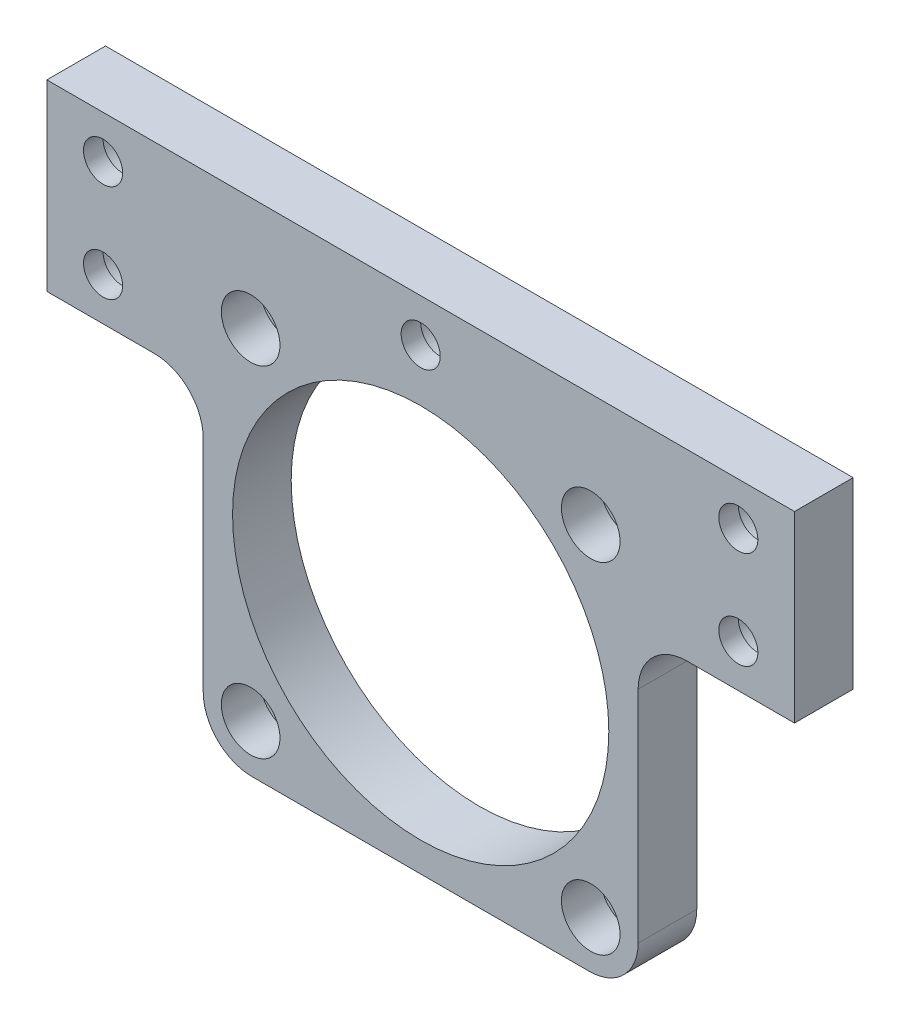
SolidWorks part; units mm, degrees
ref_plane "Front Plane" through (0, 0, 0) normal (0, 0, 1) x (1, 0, 0)
ref_plane "Top Plane" through (0, 0, 0) normal (0, 1, 0) x (1, 0, 0)
ref_plane "Right Plane" through (0, 0, 0) normal (1, 0, 0) x (0, 0, -1)
sketch "Sketch1" plane through (0, 0, 0) normal (0, 0, 1) x (1, 0, 0)
  line L1 (0, 0) -> (153, 0)
  line L2 (32, -47.5) -> (32, -92.5)
  line L3 (42, -102.5) -> (111, -102.5)
  line L4 (153, 0) -> (153, -37.5)
  line L6 (0, -37.5) -> (0, 0)
  line L13 (153, -37.5) -> (131, -37.5)
  line L15 (22, -37.5) -> (0, -37.5)
  line L16 (121, -92.5) -> (121, -47.5)
  arc A2 (131, -37.5) -> (121, -47.5) centre (131, -47.5) ccw
  arc A3 (32, -47.5) -> (22, -37.5) centre (22, -47.5) ccw
  arc A8 (32, -92.5) -> (42, -102.5) centre (42, -92.5) ccw
  arc A9 (111, -102.5) -> (121, -92.5) centre (111, -92.5) ccw
  circle A10 centre (76.5, -58) radius 38.5
  circle A20 centre (41.7, -92.8) radius 4.25
  circle A23 centre (111.3, -92.8) radius 4.25
  circle A26 centre (111.3, -23.2) radius 4.25
  circle A29 centre (41.7, -23.2) radius 4.25
  dimension "D2" = 10
  dimension "D3" = 8.5
  dimension "D4" = 77
  dimension "D1" = 153
  dimension "D5" = 32
  dimension "D6" = 41.7
  dimension "D7" = 76.5
  dimension "D8" = 111.3
  dimension "D9" = 23.2
  dimension "D10" = 37.5
  dimension "D11" = 58
  dimension "D12" = 92.8
  dimension "D13" = 102.5
extrude "Boss-Extrude1" add sketch "Sketch1" along normal blind 12
sketch "Sketch2" plane through (0, 0, 12) normal (0, 0, 1) x (1, 0, 0)
  circle A0 centre (41.7, -23.2) radius 6
  circle A1 centre (111.3, -23.2) radius 6
  circle A2 centre (41.7, -92.8) radius 6
  circle A3 centre (111.3, -92.8) radius 6
  circle A4 centre (41.7, -23.2) radius 4.25 construction
  circle A5 centre (111.3, -23.2) radius 4.25 construction
  circle A6 centre (41.7, -92.8) radius 4.25 construction
  circle A7 centre (111.3, -92.8) radius 4.25 construction
  dimension "D1" = 12
extrude "Cut-Extrude1" cut sketch "Sketch2" against normal blind 8
sketch "Sketch3" plane through (0, 0, 0) normal (0, 0, -1) x (-1, 0, 0)
  line L0 (-76.5, 0) -> (-76.5, -28.75) construction
  line L1 (-141.5, -8.75) -> (-11.5, -8.75) construction
  line L2 (-141.5, -8.75) -> (-141.5, -28.75) construction
  line L3 (-141.5, -28.75) -> (-11.5, -28.75) construction
  line L4 (-11.5, -8.75) -> (-11.5, -28.75) construction
  line L5 (-153, 0) -> (0, 0) construction
  line L6 (-153, -18.75) -> (-11.5, -18.75) construction
  line L7 (-153, -37.5) -> (-153, 0) construction
  circle A0 centre (-141.5, -8.75) radius 4
  circle A1 centre (-141.5, -28.75) radius 4
  circle A2 centre (-76.5, -8.75) radius 4
  circle A3 centre (-11.5, -8.75) radius 4
  circle A4 centre (-11.5, -28.75) radius 4
  dimension "D3" = 8
  dimension "D1" = 130
  dimension "D2" = 20
extrude "Cut-Extrude2" cut sketch "Sketch3" against normal up to surface (12 mm away)
sketch "Sketch4" plane through (0, 0, 0) normal (0, 0, -1) x (-1, 0, 0)
  circle A0 centre (-141.5, -8.75) radius 6
  circle A1 centre (-141.5, -28.75) radius 6
  circle A2 centre (-76.5, -8.75) radius 6
  circle A3 centre (-11.5, -8.75) radius 6
  circle A4 centre (-11.5, -28.75) radius 6
  circle A5 centre (-141.5, -8.75) radius 4 construction
  circle A6 centre (-141.5, -28.75) radius 4 construction
  circle A7 centre (-76.5, -8.75) radius 4 construction
  circle A9 centre (-11.5, -28.75) radius 4 construction
  circle A10 centre (-11.5, -8.75) radius 4 construction
  dimension "D1" = 12
extrude "Cut-Extrude3" cut sketch "Sketch4" against normal blind 8
